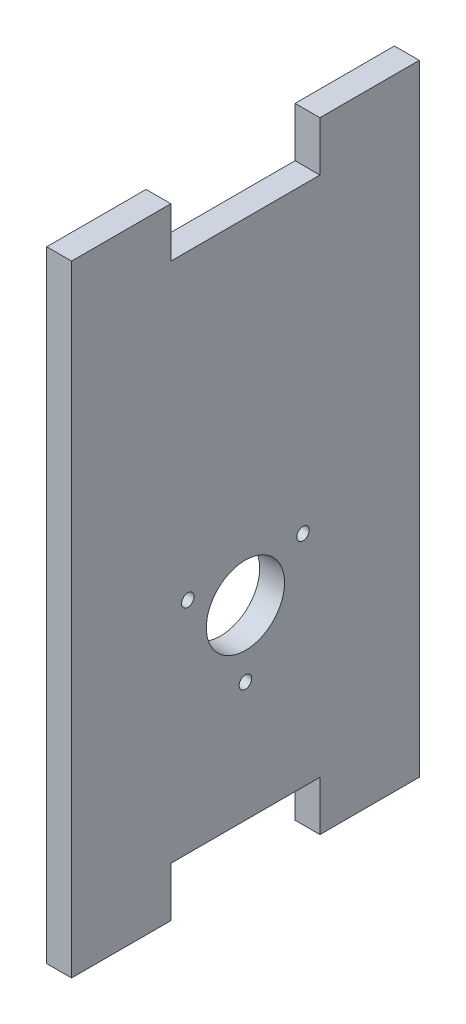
SolidWorks part; units mm, degrees
ref_plane "Front" through (0, 0, 0) normal (0, 0, 1) x (1, 0, 0)
ref_plane "Top" through (0, 0, 0) normal (0, 1, 0) x (1, 0, 0)
ref_plane "Right" through (0, 0, 0) normal (1, 0, 0) x (0, 0, -1)
sketch "Sketch1" plane through (0, 0, 0) normal (1, 0, 0) x (0, 0, -1)
  line L0 (-9.525, 0) -> (-9.525, -6.35)
  line L1 (-22.225, 73.025) -> (-9.525, 73.025)
  line L2 (-22.225, 73.025) -> (-22.225, -6.35)
  line L3 (-9.525, 0) -> (9.525, 0)
  line L4 (0, 0) -> (0, 66.675) construction
  line L5 (-9.525, -6.35) -> (-22.225, -6.35)
  line L6 (9.525, 73.025) -> (9.525, 66.675)
  line L7 (9.525, -6.35) -> (22.225, -6.35)
  line L8 (22.225, 73.025) -> (22.225, -6.35)
  line L9 (22.225, 73.025) -> (9.525, 73.025)
  line L10 (-9.525, 73.025) -> (-9.525, 66.675)
  line L11 (9.525, 0) -> (9.525, -6.35)
  line L12 (-9.525, 66.675) -> (9.525, 66.675)
  circle A0 centre (0, 23.8125) radius 5
  circle A1 centre (0, 23.8125) radius 8.5 construction
  circle A2 centre (0, 15.3125) radius 0.8
  circle A3 centre (-7.3612, 28.0625) radius 0.8
  circle A4 centre (7.3612, 28.0625) radius 0.8
  dimension "D4" = 10
  dimension "D7" = 17
  dimension "D8" = 1.6
  dimension "D1" = 19.05
  dimension "D2" = 6.35
  dimension "D3" = 66.675
  dimension "D5" = 23.8125
  dimension "D6" = 12.7
extrude "Extrude1" add sketch "Sketch1" along normal blind 3.175
